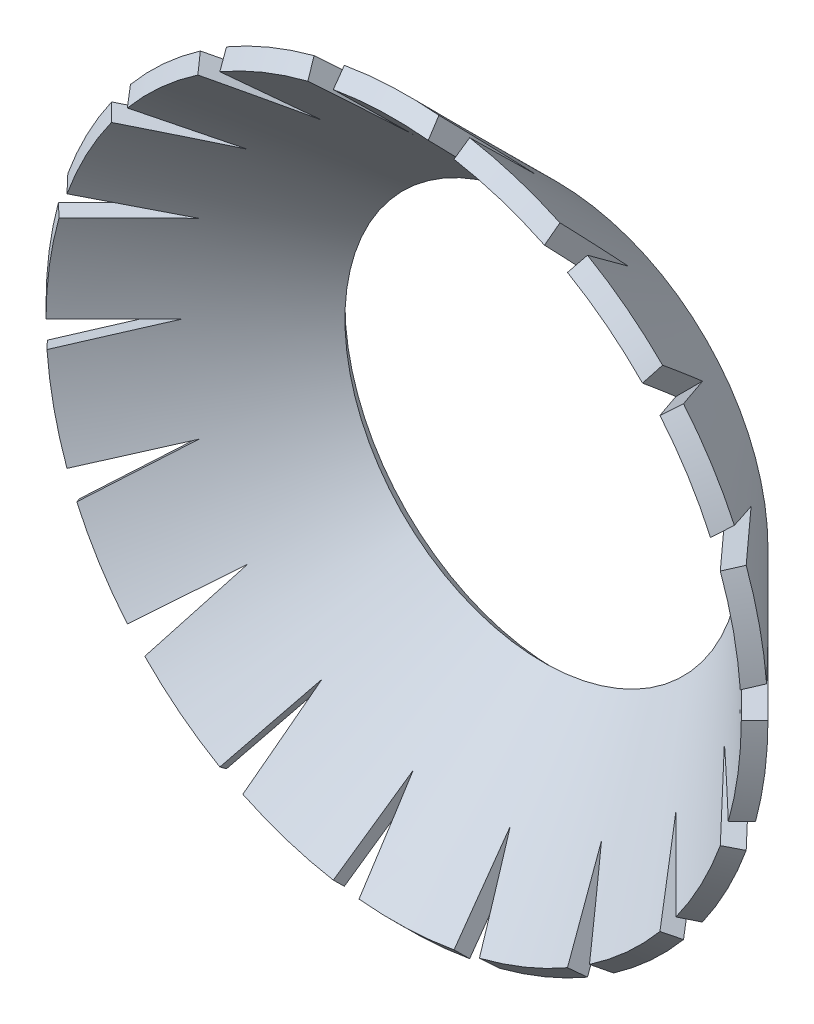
SolidWorks part; units mm, degrees
ref_plane "Front Plane" through (0, 0, 0) normal (0, 0, 1) x (1, 0, 0)
ref_plane "Top Plane" through (0, 0, 0) normal (0, 1, 0) x (1, 0, 0)
ref_plane "Right Plane" through (0, 0, 0) normal (1, 0, 0) x (0, 0, -1)
sketch "BodySke" plane through (0, 0, 0) normal (0, 1, 0) x (1, 0, 0)
  line L0 (0, -1.6) -> (0, 3.997) construction
  line L1 (0, 0) -> (7.65, 0) construction
  line L2 (7.65, 0) -> (5.2387, 2.4113) construction
  line L3 (7.65, 0) -> (4.4828, 3.1672)
  line L4 (7.65, 0) -> (7.3672, -0.2828)
  line L5 (7.3672, -0.2828) -> (4.2, 2.8843)
  line L6 (4.2, 2.8843) -> (4.4828, 3.1672)
  line L7 (0, 0) -> (-18, 0) construction
  dimension "Angle" = 45
  dimension "Outer_dia" = 15.3
  dimension "Inner_dia" = 8.4
  dimension "Thickness" = 0.4
  dimension "Num_tooth" = 18
revolve "BaseBody" add sketch "BodySke" angle 360 about L0
sketch "ToothSke" plane through (0, 0, 0) normal (0, 0, 1) x (1, 0, 0)
  line L0 (0, 0) -> (4.8783, 0) construction
  line L1 (7.65, 0) -> (7.65, 0.6676)
  line L2 (7.65, -0.6676) -> (7.65, 0.6676) construction
  line L4 (5.925, 0) -> (7.65, 0.6676)
  line L5 (5.925, 0) -> (7.65, 0)
  circle A0 centre (0, 0) radius 7.65 construction
  circle A1 centre (0, 0) radius 7.65 construction
  arc A2 (-5.925, 0) -> (5.9026, 0.5147) centre (0, 0) ccw construction
  point P9 (7.65, 0)
  dimension "D1" = 11.85
  dimension "D2" = 1.3352
extrude "ToothCut" cut sketch "ToothSke" against normal through all and the other way through all
pattern_circular "ToothPat" count 18 over 360 about axis through (0, 0, 0) along (0, 0, 1) of "ToothCut"
equation "\"D1@ToothSke\" =  ( \"Outer_dia@BodySke\" + \"Inner_dia@BodySke\" )  / 2"
equation "\"D2@ToothSke\" = pi  * \"Outer_dia@BodySke\" / 2 / \"Num_tooth@BodySke\""
equation "\"Num_tooth@ToothPat\" = \"Num_tooth@BodySke\""
